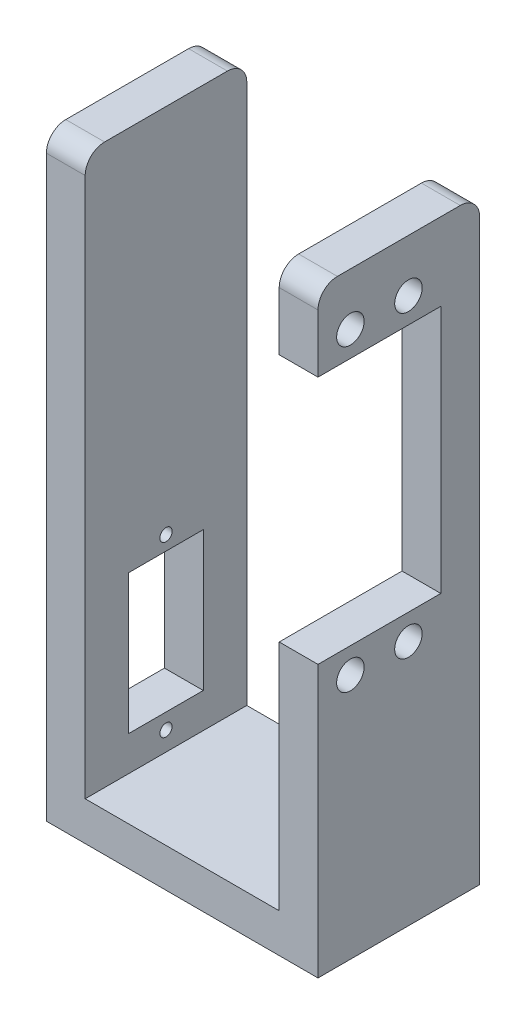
SolidWorks part; units mm, degrees
ref_plane "Front Plane" through (0, 0, 0) normal (0, 0, 1) x (1, 0, 0)
ref_plane "Top Plane" through (0, 0, 0) normal (0, 1, 0) x (1, 0, 0)
ref_plane "Right Plane" through (0, 0, 0) normal (1, 0, 0) x (0, 0, -1)
imported_body "Elbow 1-1-solid1"
sketch "Sketch2" plane through (-19.6196, 0, 0) normal (-1, 0, 0) x (0, 0, 1)
  line L6 (0.0553, -25.1745) -> (12.2553, -25.1745)
  line L7 (0.0553, -25.1745) -> (0.0553, -47.9745)
  line L8 (0.0553, -47.9745) -> (12.2553, -47.9745)
  line L9 (12.2553, -25.1745) -> (12.2553, -47.9745)
  circle A1 centre (6.1553, -22.8343) radius 1.0097
  circle A2 centre (6.1553, -50.5194) radius 1
  point P15 (6.1553, -36.5745)
  dimension "D1" = 2.0195
  dimension "D2" = 2
  dimension "D3" = 22.8
  dimension "D4" = 12.2
extrude "Cut-Extrude5" cut sketch "Sketch2" against normal blind 14
